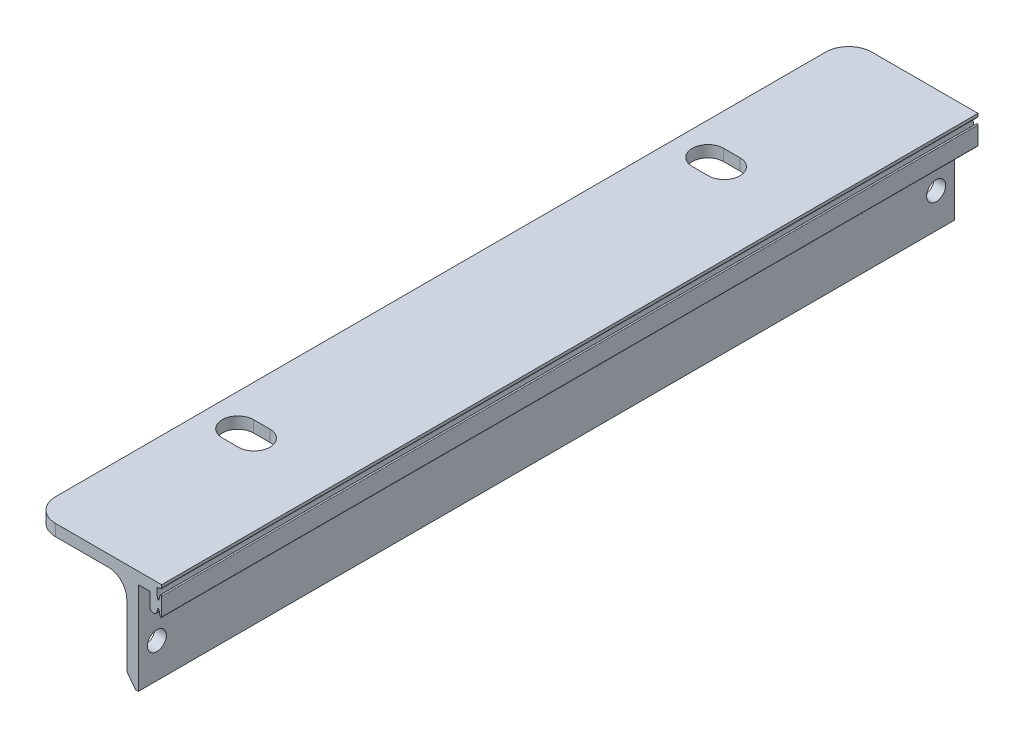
SolidWorks part; units mm, degrees
ref_plane "前视基准面" through (0, 0, 0) normal (0, 0, 1) x (1, 0, 0)
ref_plane "上视基准面" through (0, 0, 0) normal (0, 1, 0) x (1, 0, 0)
ref_plane "右视基准面" through (0, 0, 0) normal (1, 0, 0) x (0, 0, -1)
sketch "草图1" plane through (0, 0, 0) normal (0, 0, 1) x (1, 0, 0)
  line L0 (2329.984, -3290.1038) -> (2357.924, -3290.1038)
  line L1 (2329.984, -3292.6038) -> (2350.384, -3292.6038)
  line L2 (2352.884, -3292.6038) -> (2355.384, -3292.6038)
  line L3 (2350.384, -3292.6038) -> (2350.384, -3310.1038)
  line L4 (2352.884, -3292.6038) -> (2352.884, -3312.6038)
  line L6 (2357.924, -3290.1038) -> (2357.924, -3290.6784)
  line L8 (2329.984, -3290.1038) -> (2329.984, -3292.6038)
  line L9 (2355.384, -3292.6038) -> (2355.384, -3295.5205)
  line L10 (2352.884, -3312.6038) -> (2352.284, -3312.6038)
  line L11 (2350.384, -3310.1038) -> (2352.284, -3312.6038)
  line L14 (2356.9332, -3295.6826) -> (2357.0658, -3295.056)
  line L15 (2357.924, -3292.2796) -> (2357.924, -3296.128)
  line L17 (2357.1229, -3291.0635) -> (2357.672, -3290.9746)
  line L18 (2357.3611, -3295.0491) -> (2357.5873, -3296.1683)
  line L19 (2357.5884, -3292.2343) -> (2357.3601, -3293.2128)
  arc A0 (2356.8711, -3291.3476) -> (2357.0651, -3293.1963) centre (2363.3121, -3291.6063) ccw
  arc A1 (2357.672, -3290.9746) -> (2357.924, -3290.6784) centre (2357.624, -3290.6784) ccw
  arc A2 (2357.1229, -3291.0635) -> (2356.8711, -3291.3476) centre (2357.1709, -3291.3596) ccw
  arc A3 (2357.3611, -3295.0491) -> (2357.0658, -3295.056) centre (2357.214, -3295.0788) ccw
  arc A4 (2357.5873, -3296.1683) -> (2357.924, -3296.128) centre (2357.754, -3296.1346) ccw
  arc A5 (2357.0651, -3293.1963) -> (2357.3601, -3293.2128) centre (2357.214, -3293.1788) ccw
  arc A6 (2357.924, -3292.2796) -> (2357.5884, -3292.2343) centre (2357.754, -3292.2729) ccw
  arc A7 (2355.384, -3295.5205) -> (2356.9332, -3295.6826) centre (2356.1671, -3295.5205) ccw
  dimension "D1" = 20
  dimension "D2" = 0.6
  dimension "D3" = 2.5
  dimension "D4" = 20.4
  dimension "D5" = 127.235
extrude "凸台-拉伸1" add sketch "草图1" along normal mid plane 176.45
sketch "草图2" plane through (0, -3290.1038, 0) normal (0, 1, 0) x (1, 0, 0)
  line L0 (2338.734, 54.2) -> (2338.734, 47.4) construction
  line L2 (2357.924, 88.225) -> (2329.984, 88.225) construction
  line L3 (2357.924, 0) -> (2329.984, 0) construction
  line L4 (2357.924, -88.225) -> (2357.924, 88.225) construction
  line L5 (2329.984, -88.225) -> (2329.984, 88.225) construction
  line L6 (2340.484, -47.4) -> (2336.984, -47.4)
  line L7 (2340.484, -54.2) -> (2336.984, -54.2)
  line L9 (2340.484, 54.2) -> (2336.984, 54.2)
  line L10 (2340.484, 47.4) -> (2336.984, 47.4)
  arc A0 (2336.984, -54.2) -> (2336.984, -47.4) centre (2336.984, -50.8) cw
  arc A1 (2336.984, 54.2) -> (2336.984, 47.4) centre (2336.984, 50.8) ccw
  arc A2 (2340.484, -47.4) -> (2340.484, -54.2) centre (2340.484, -50.8) cw
  arc A4 (2340.484, 47.4) -> (2340.484, 54.2) centre (2340.484, 50.8) ccw
  dimension "D4" = 8.75
  dimension "D1" = 37.425
  dimension "D5" = 3.5
  dimension "D6" = 3.4
extrude "切除-拉伸1" cut sketch "草图2" against normal through all
sketch "草图3" plane through (2350.384, 0, 0) normal (-1, 0, 0) x (0, 0, 1)
  line L0 (-88.225, -3292.6038) -> (-88.225, -3310.1038) construction
  line L1 (88.225, -3290.1038) -> (-88.225, -3290.1038) construction
  line L2 (0, -3290.1038) -> (0, -3328.2905) construction
  circle A0 centre (-84.225, -3305.1038) radius 2.05
  circle A1 centre (84.225, -3305.1038) radius 2.05
  circle A2 centre (-84.225, -3325.1038) radius 2.05
  circle A3 centre (84.225, -3325.1038) radius 2.05
  dimension "D1" = 4.1
  dimension "D2" = 4
  dimension "D3" = 15
  dimension "D4" = 2
extrude "切除-拉伸2" cut sketch "草图3" against normal through all
fillet "圆角1" radius 5 2 edges at (2329.984, -3291.3538, -88.225) (2329.984, -3291.3538, 88.225)
fillet "圆角2" radius 4 1 edges at (2350.384, -3292.6038, 0)
equation "\"切除-拉伸3\" = if ( \"D1@凸台-拉伸1\" = 176.45 , \"unsuppressed\" , \"suppressed\" )"
equation "\"切除-拉伸4\" = if ( \"D1@凸台-拉伸1\" = 220.9 , \"unsuppressed\" , \"suppressed\" )"
equation "\"切除-拉伸5\" = if ( \"D1@凸台-拉伸1\" = 265.35 , \"unsuppressed\" , \"suppressed\" )"
equation "\"切除-拉伸6\" = if ( \"D1@凸台-拉伸1\" = 265.35 , \"unsuppressed\" , \"suppressed\" )"
equation "\"切除-拉伸7\"= if ( \"D1@凸台-拉伸1\" = 265.35 , \"unsuppressed\" , \"suppressed\" )"
equation "\"切除-拉伸8\" = if ( \"D1@凸台-拉伸1\" = 132 , \"unsuppressed\" , \"suppressed\" )"
